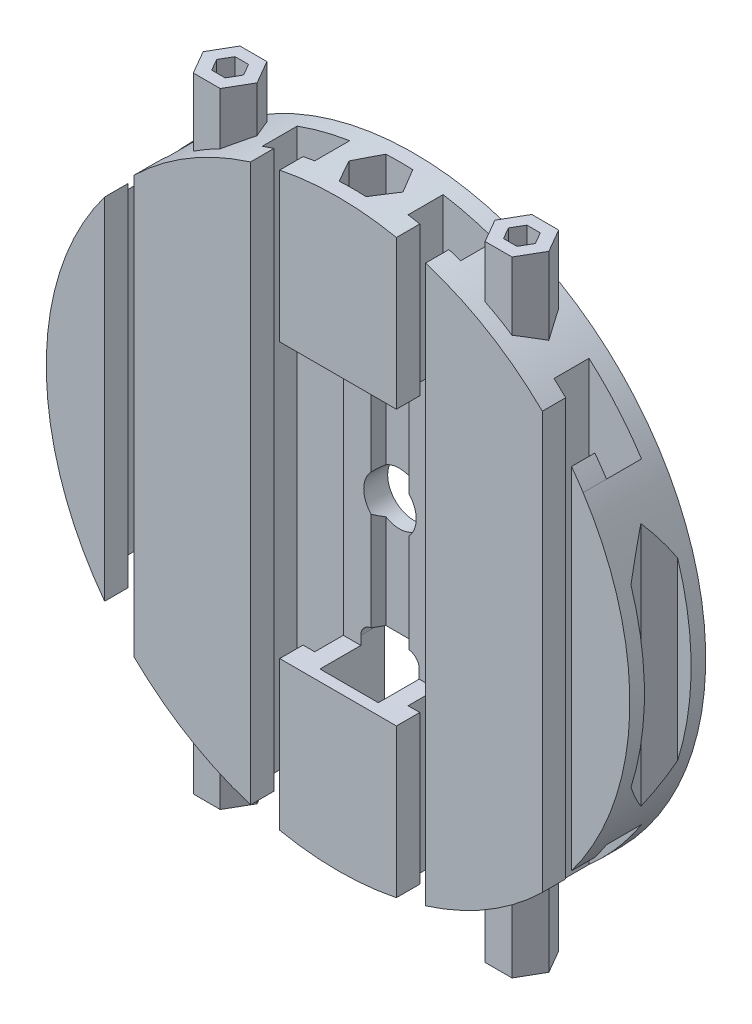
SolidWorks part; units mm, degrees
ref_plane "Plan de face" through (0, 0, 0) normal (0, 0, 1) x (1, 0, 0)
ref_plane "Plan de dessus" through (0, 0, 0) normal (0, 1, 0) x (1, 0, 0)
ref_plane "Plan de droite" through (0, 0, 0) normal (1, 0, 0) x (0, 0, -1)
sketch "Esquisse1" plane through (0, 0, 0) normal (0, 0, 1) x (1, 0, 0)
  line L6 (35.7636, 358.7862) -> (-423.8647, -437.3133) construction
  line L7 (-755.4678, -148.4209) -> (879.7592, -148.4209) construction
  line L8 (-46.1325, 376.7457) -> (415.4529, -422.7436) construction
  line L9 (257.0726, -148.4209) -> (-245.0999, 141.5085) construction
  line L10 (-257.0726, -148.4209) -> (263.2247, 151.9729) construction
  line L11 (-55, 201.5791) -> (55, 201.5791)
  line L12 (-147.0726, -148.4209) -> (147.0726, -148.4209)
  line L13 (147.0726, -148.4209) -> (202.0726, -53.1581)
  line L14 (202.0726, -53.1581) -> (55, 201.5791)
  line L15 (-147.0726, -148.4209) -> (-202.0726, -53.1581)
  line L16 (-202.0726, -53.1581) -> (-55, 201.5791)
  dimension "D1" = 60
  dimension "D2" = 60
  dimension "D3" = 110
  dimension "D4" = 350
  dimension "D5" = 60
  dimension "D6" = 60
  dimension "D7" = 110
  dimension "D8" = 110
extrude "Boss.-Extru.2" add sketch "Esquisse1" along normal blind 13
sketch "Esquisse3" plane through (0, 201.5791, 0) normal (0, 1, 0) x (1, 0, 0)
  line L0 (-12.5, 6.793) -> (-12.5, -19.2478) construction
  line L1 (-8, -3) -> (-17, -3)
  line L2 (-17, -3) -> (-17, -9)
  line L3 (-17, -9) -> (-15, -9)
  line L4 (-15, -9) -> (-15, -13)
  line L5 (55, -13) -> (-55, -13) construction
  line L6 (-10, -9) -> (-10, -13)
  line L7 (-8, -9) -> (-10, -9)
  line L8 (-8, -3) -> (-8, -9)
  line L9 (-15, -13) -> (-10, -13)
  point P2 (-12.5, -13)
  point P14 (-12.5, -3)
  dimension "D1" = 12.5
  dimension "D2" = 9
  dimension "D3" = 5
  dimension "D4" = 6
  dimension "D5" = 4
extrude "Enlèv. mat.-Extru.1" cut sketch "Esquisse3" against normal up to next
pattern_linear "Répétition linéaire1" count 8 spacing 25 along (1, 0, 0) of "Enlèv. mat.-Extru.1"
pattern_linear "Répétition linéaire2" count 7 spacing 25 along (-1, 0, 0) of "Enlèv. mat.-Extru.1"
sketch "3parties" plane through (0, 0, 0) normal (0, 0, 1) x (1, 0, 0)
  line L2 (-50, 0) -> (-171.3817, 0)
  line L3 (-165, 11.0535) -> (-202.0726, -53.1581) construction
  line L4 (50, 0) -> (171.3817, 0)
  line L5 (202.0726, -53.1581) -> (165, 11.0535) construction
  line L6 (0, -50) -> (0, -148.4209)
  line L7 (-10, -148.4209) -> (10, -148.4209) construction
  circle A0 centre (0, 0) radius 50
  dimension "D1" = 100
sketch "certcleRotules" plane through (0, 0, 13) normal (0, 0, 1) x (1, 0, 0)
  circle A0 centre (0, 0) radius 157.5
  dimension "D1" = 315
sketch "Esquisse6" plane through (0, 0, 0) normal (0, 1, 0) x (1, 0, 0)
  line L0 (-157.5, -13) -> (157.5, -13) construction
  line L1 (0, 0) -> (-4.5, 0)
  line L2 (0, 0) -> (0, -13)
  line L3 (-2.5, -9) -> (-4.5, -9)
  line L4 (-4.5, 0) -> (-4.5, -9)
  line L7 (0, -13) -> (-2.5, -13)
  line L8 (-2.5, -9) -> (-2.5, -13)
  dimension "D1" = 4.5
  dimension "D2" = 2.5
  dimension "D3" = 4
revolve "Enlèvement de matière-Révolution1" cut sketch "Esquisse6" angle 360 about L2
pattern_linear "Répétition linéaire3" count 4 spacing 50 along (0, 1, 0) count 4 spacing 50 along (1, 0, 0) of "Enlèvement de matière-Révolution1"
pattern_linear "Répétition linéaire5" count 3 spacing 50 along (0, -1, 0) count 4 spacing 50 along (1, 0, 0) of "Enlèvement de matière-Révolution1"
pattern_linear "Répétition linéaire6" count 4 spacing 50 along (0, 1, 0) count 4 spacing 50 along (-1, 0, 0) of "Enlèvement de matière-Révolution1"
pattern_linear "Répétition linéaire7" count 3 spacing 50 along (0, -1, 0) count 4 spacing 50 along (-1, 0, 0) of "Enlèvement de matière-Révolution1"
sketch "Esquisse8" plane through (0, 0, 0) normal (0, 0, -1) x (-1, 0, 0)
  circle A0 centre (0, 100) radius 4.5 construction
  circle A1 centre (0, 100) radius 4.5
extrude "bouchonBarreauHaut" add sketch "Esquisse8" against normal blind 13
sketch "Esquisse7" plane through (0, 0, 0) normal (0, 0, -1) x (-1, 0, 0)
  line L1 (-6.5, 105.15) -> (6.5, 105.15)
  line L2 (-6.5, 105.15) -> (-6.5, 80.15)
  line L3 (-6.5, 80.15) -> (6.5, 80.15)
  line L4 (6.5, 105.15) -> (6.5, 80.15)
  line L5 (0, 7.15) -> (0, -7.15) construction
  dimension "D1" = 25
  dimension "D2" = 80.15
  dimension "D3" = 13
  dimension "D4" = 6.5
extrude "Boss.-Extru.4" add sketch "Esquisse7" along normal blind 5
sketch "Esquisse9" plane through (0, 0, 0) normal (1, 0, 0) x (0, 0, -1)
  line L0 (5, 80.15) -> (0, 80.15) construction
  line L1 (5, 80.15) -> (5, 105.15) construction
  line L3 (5, 85.15) -> (5, 82.5)
  line L4 (5, 82.5) -> (-3, 82.5)
  line L6 (-3, -148.4209) -> (-3, 201.5791) construction
  line L7 (-13, 157.5) -> (-13, -157.5) construction
  line L8 (-3, 79.15) -> (-13, 79.15)
  line L9 (-3, 79.15) -> (-3, 82.5)
  line L10 (5, 85.15) -> (-13, 85.15)
  line L11 (-13, 79.15) -> (-13, 85.15)
  dimension "D1" = 5
  dimension "D2" = 2.65
  dimension "D3" = 6
revolve "Enlèvement de matière-Révolution2" cut sketch "Esquisse9" angle 360 about L10
pattern_linear "Répétition linéaire8" count 2 spacing 15 along (0, 1, 0) of "Enlèvement de matière-Révolution2"
pattern_circular "Répétition circulaire1" count 3 every 120 about axis through (0, 0, 0) along (0, 0, 1) of "Boss.-Extru.4", "Enlèvement de matière-Révolution2", "Répétition linéaire8"
sketch "Esquisse10" plane through (0, 0, 0) normal (1, 0, 0) x (0, 0, -1)
  line L0 (0, 201.5791) -> (0, -53.1581) construction
  line L1 (0, 77.5) -> (5, 77.5)
  line L2 (0, 77.5) -> (0, 72.5)
  line L3 (0, 72.5) -> (5, 72.5)
  line L4 (5, 77.5) -> (5, 72.5)
  line L5 (0, 50) -> (0, -50) construction
  line L6 (0, -72.5) -> (5, -72.5)
  line L7 (0, -72.5) -> (0, -77.5)
  line L8 (0, -77.5) -> (5, -77.5)
  line L9 (5, -72.5) -> (5, -77.5)
  line L10 (5, 80.15) -> (5, 105.15) construction
  line L11 (-9, 50) -> (0, 50) construction
  line L13 (-9, -100) -> (0, -100) construction
  point P16 (2.5, 72.5)
  point P19 (2.5, -72.5)
  dimension "D1" = 22.5
  dimension "D2" = 5
  dimension "D3" = 22.5
  dimension "D4" = 5
extrude "Boss.-Extru.6" add sketch "Esquisse10" along normal mid plane 250
chamfer "Chanfrein1" distance 5 angle 60 4 edges at (125, -75, -5) (-125, -75, -5) (-125, 75, -5) (125, 75, -5)
sketch "Esquisse11" plane through (0, 0, 13) normal (0, 0, 1) x (1, 0, 0)
  line L0 (-10, -148.4209) -> (-10, 201.5791) construction
  line L1 (-10, 23.5) -> (10, 23.5)
  line L2 (-10, 23.5) -> (-10, -23.5)
  line L3 (-10, -23.5) -> (10, -23.5)
  line L4 (10, 23.5) -> (10, -23.5)
  line L5 (10, -148.4209) -> (10, 201.5791) construction
  dimension "D1" = 47
  dimension "D2" = 23.5
extrude "Enlèv. mat.-Extru.2" cut sketch "Esquisse11" against normal blind 8.9
sketch "Esquisse13" plane through (0, 0, 0) normal (-1, 0, 0) x (0, 0, 1)
  line L1 (4.1, -23.5) -> (11.1, -23.5)
  line L2 (4.1, -23.5) -> (4.1, -40)
  line L3 (4.1, -40) -> (6.1, -40)
  line L4 (11.1, -23.5) -> (11.1, -35)
  arc A0 (6.1, -40) -> (11.1, -35) centre (6.1, -35) ccw
  dimension "D2" = 5
  dimension "D1" = 16.5
  dimension "D3" = 7
extrude "Enlèv. mat.-Extru.3" cut sketch "Esquisse13" against normal mid plane 10
sketch "Esquisse14" plane through (0, 0, 4.1) normal (0, 0, 1) x (1, 0, 0)
  line L1 (-3, -20) -> (3, -20)
  line L2 (-5, -22) -> (-5, -38)
  line L3 (-3, -40) -> (3, -40)
  line L4 (5, -22) -> (5, -38)
  line L6 (5, -40) -> (-5, -40) construction
  line L7 (-5, -23.5) -> (-5, -40) construction
  line L8 (5, -23.5) -> (5, -40) construction
  arc A0 (-5, -38) -> (-3, -40) centre (-3, -38) ccw
  arc A1 (3, -40) -> (5, -38) centre (3, -38) ccw
  arc A2 (3, -20) -> (5, -22) centre (3, -22) cw
  arc A3 (-3, -20) -> (-5, -22) centre (-3, -22) ccw
  point P16 (5, -20)
  point P19 (-5, -20)
  dimension "D3" = 2
  dimension "D1" = 20
extrude "Enlèv. mat.-Extru.4" cut sketch "Esquisse14" against normal up to next
mirror "Symétrie1" about plane through (0, 0, 0) normal (0, 1, 0) of "Enlèv. mat.-Extru.4", "Enlèv. mat.-Extru.3"
sketch "Esquisse15" plane through (0, 0, 0) normal (0, 0, -1) x (-1, 0, 0)
  circle A0 centre (-50, 0) radius 4.5 construction
  circle A1 centre (0, -50) radius 4.5 construction
  circle A2 centre (50, 0) radius 4.5 construction
  circle A3 centre (0, 50) radius 4.5 construction
  circle A4 centre (-50, 0) radius 4.5
  circle A5 centre (0, -50) radius 4.5
  circle A6 centre (50, 0) radius 4.5
  circle A7 centre (0, 50) radius 4.5
extrude "boucheTrousCEntre" add sketch "Esquisse15" against normal up to surface (13 mm away)
sketch "Esquisse16" plane through (0, -148.4209, 0) normal (0, -1, 0) x (1, 0, 0)
  line L0 (0, -9.9) -> (0, 9.9) construction
  line L1 (-2.3094, 2.5) -> (2.3094, 2.5)
  line L2 (2.3094, 2.5) -> (4.6188, 6.5)
  line L3 (4.6188, 6.5) -> (2.3094, 10.5)
  line L4 (2.3094, 10.5) -> (-2.3094, 10.5)
  line L5 (-2.3094, 10.5) -> (-4.6188, 6.5)
  line L6 (-4.6188, 6.5) -> (-2.3094, 2.5)
  line L8 (-10, 13) -> (10, 13) construction
  circle A0 centre (0, 6.5) radius 4 construction
  dimension "D1" = 6.5
  dimension "D2" = 8
extrude "Enlèv. mat.-Extru.5" cut sketch "Esquisse16" against normal through all
pattern_linear "Répétition linéaire9" count 8 spacing 25 along (1, 0, 0) of "Enlèv. mat.-Extru.5"
pattern_linear "Répétition linéaire10" count 8 spacing 25 along (-1, 0, 0) of "Enlèv. mat.-Extru.5"
sketch "Esquisse17" plane through (0, 0, 0) normal (0, 0, 1) x (1, 0, 0)
  line L0 (-55, 201.5791) -> (55, 201.5791) construction
  line L1 (202.0726, -53.1581) -> (55, 201.5791) construction
  line L2 (147.0726, -148.4209) -> (202.0726, -53.1581) construction
  line L3 (-147.0726, -148.4209) -> (147.0726, -148.4209) construction
  line L4 (-147.0726, -148.4209) -> (-202.0726, -53.1581) construction
  line L5 (-202.0726, -53.1581) -> (-55, 201.5791) construction
  line L6 (-55, 201.5791) -> (55, 201.5791)
  line L7 (202.0726, -53.1581) -> (55, 201.5791)
  line L8 (147.0726, -148.4209) -> (202.0726, -53.1581)
  line L9 (-147.0726, -148.4209) -> (147.0726, -148.4209)
  line L10 (-147.0726, -148.4209) -> (-202.0726, -53.1581)
  line L11 (-202.0726, -53.1581) -> (-55, 201.5791)
  circle A0 centre (0, 0) radius 50 construction
  circle A1 centre (0, 0) radius 50
extrude "Enlèv. mat.-Extru.6" cut sketch "Esquisse17" against normal through all both and the other way through all
sketch "Esquisse19" plane through (0, 23.5, 0) normal (0, 1, 0) x (1, 0, 0)
  line L0 (20.3812, -6.5) -> (22.6906, -2.5) construction
  line L1 (22.6906, -2.5) -> (27.3094, -2.5) construction
  line L2 (27.3094, -2.5) -> (29.6188, -6.5) construction
  line L3 (29.6188, -6.5) -> (27.3094, -10.5) construction
  line L4 (27.3094, -10.5) -> (22.6906, -10.5) construction
  line L5 (22.6906, -10.5) -> (20.3812, -6.5) construction
  line L6 (20.3812, -6.5) -> (22.6906, -2.5)
  line L7 (22.6906, -2.5) -> (27.3094, -2.5)
  line L8 (27.3094, -2.5) -> (29.6188, -6.5)
  line L9 (29.6188, -6.5) -> (27.3094, -10.5)
  line L10 (27.3094, -10.5) -> (22.6906, -10.5)
  line L11 (22.6906, -10.5) -> (20.3812, -6.5)
  line L13 (26.1547, -8.5) -> (27.3094, -6.5)
  line L14 (27.3094, -6.5) -> (26.1547, -4.5)
  line L15 (26.1547, -4.5) -> (23.8453, -4.5)
  line L16 (23.8453, -4.5) -> (22.6906, -6.5)
  line L17 (22.6906, -6.5) -> (23.8453, -8.5)
  line L18 (23.8453, -8.5) -> (26.1547, -8.5)
  circle A0 centre (25, -6.5) radius 2 construction
  dimension "D1" = 4
  dimension "D2" = 2
  dimension "D3" = 2
extrude "Boss.-Extru.7" add sketch "Esquisse19" along normal blind 30
mirror "Symétrie2" about plane through (0, 0, 0) normal (1, 0, 0) of "Boss.-Extru.7"
mirror "Symétrie3" about plane through (0, 0, 0) normal (0, 1, 0) of "Symétrie2", "Boss.-Extru.7"
